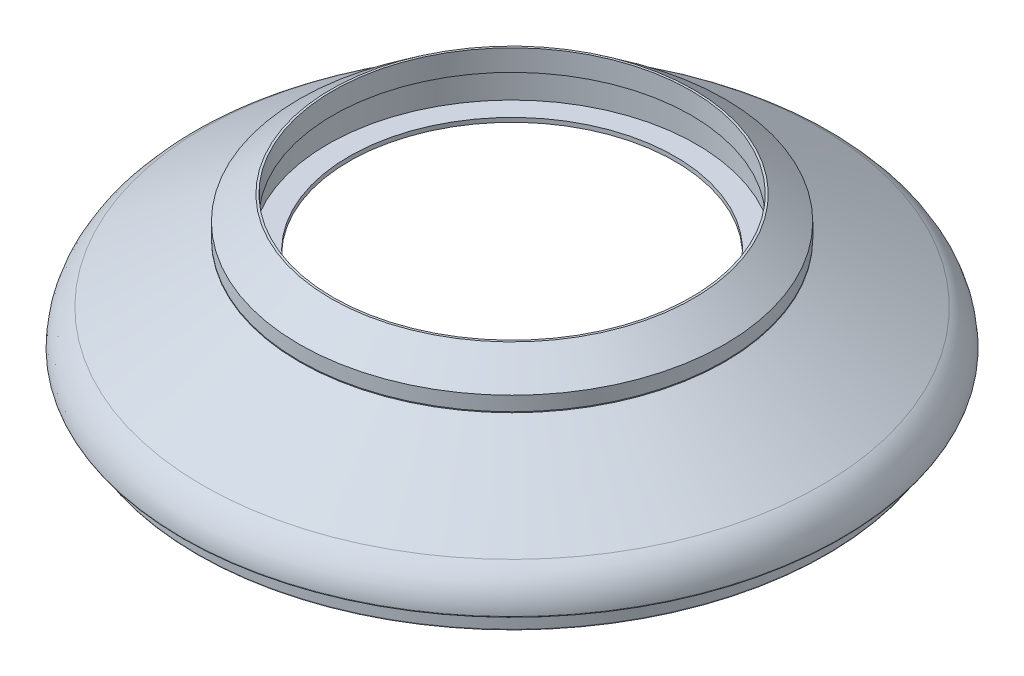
SolidWorks part; units mm, degrees
ref_plane "Front Plane" through (0, 0, 0) normal (0, 0, 1) x (1, 0, 0)
ref_plane "Top Plane" through (0, 0, 0) normal (0, 1, 0) x (1, 0, 0)
ref_plane "Right Plane" through (0, 0, 0) normal (1, 0, 0) x (0, 0, -1)
ref_axis "Axis1" through (0, 40.2244, 0) along (0, -1, 0)
sketch "Sketch1" plane through (0, 0, 0) normal (0, 0, 1) x (1, 0, 0)
  line L0 (0, 0) -> (0, 33.5588) construction
  line L1 (-108.2167, 29.21) -> (-106.9467, 29.21)
  line L2 (-106.9467, 29.21) -> (-106.9467, 16.51)
  line L3 (-106.9467, 16.51) -> (-110.0455, 16.51)
  line L4 (-110.0455, 16.51) -> (-110.0455, 0)
  line L5 (-97.3455, -2.54) -> (-169.9663, -41.207)
  line L6 (-108.2167, 29.21) -> (-127, 14.8947)
  line L8 (-187.3546, -63.627) -> (-184.1796, -63.627)
  line L9 (-183.4287, -63.627) -> (-183.4287, -99.7543) construction
  line L10 (-110.0455, 0) -> (-97.3455, 0)
  line L11 (-97.3455, 0) -> (-97.3455, -2.54)
  line L13 (109.5375, 16.51) -> (-109.5375, 16.51) construction
  line L14 (-106.4387, 267.0824) -> (-106.4387, 16.51) construction
  line L15 (-109.5375, 16.51) -> (-109.5375, 3.81) construction
  line L16 (-23.5253, -38.227) -> (-37.6398, -38.227) construction
  line L17 (-127, 14.8947) -> (-127, 6.35)
  line L18 (-127, 6.35) -> (-119.6005, 6.35)
  line L19 (-119.6005, 6.35) -> (-119.6005, 5.842)
  line L20 (-119.6005, 5.842) -> (-127, 5.842)
  line L21 (-184.6605, -29.2253) -> (-127, 5.842)
  line L22 (-196.0884, -50.927) -> (-193.1966, -50.927)
  line L23 (-188.1166, -56.007) -> (-188.1166, -62.865)
  arc A0 (-183.4179, -62.8872) -> (-169.9663, -41.207) centre (-158.0287, -63.627) cw
  arc A1 (-184.1796, -63.627) -> (-183.4179, -62.8872) centre (-184.1796, -62.865) ccw
  arc A2 (-188.1166, -62.865) -> (-187.3546, -63.627) centre (-187.3546, -62.865) ccw
  arc A3 (-184.6605, -29.2253) -> (-196.85, -50.1414) centre (-171.4622, -50.927) ccw
  arc A4 (-193.1966, -50.927) -> (-188.1166, -56.007) centre (-193.1966, -56.007) cw
  arc A5 (-196.0884, -50.927) -> (-196.85, -50.1414) centre (-196.0884, -50.165) cw
  dimension "D10" = 0.762
  dimension "D11" = 25.4
  dimension "D12" = 25.4
  dimension "D13" = 5.08
  dimension "D17" = 0.762
  dimension "D1" = 2.54
  dimension "D2" = 3.175
  dimension "D4" = 0.508
  dimension "D5" = 0.508
  dimension "D6" = 1.27
  dimension "D7" = 25.4
  dimension "D8" = 12.7
  dimension "D9" = 12.7
  dimension "D14" = 254
  dimension "D15" = 10.16
  dimension "D16" = 0.508
  dimension "D18" = 393.7
  dimension "D19" = 8.7334
  dimension "D20" = 12.7
revolve "Revolve1" add sketch "Sketch1" angle 360 about axis through (0, 40.2244, 0) along (0, -1, 0)
